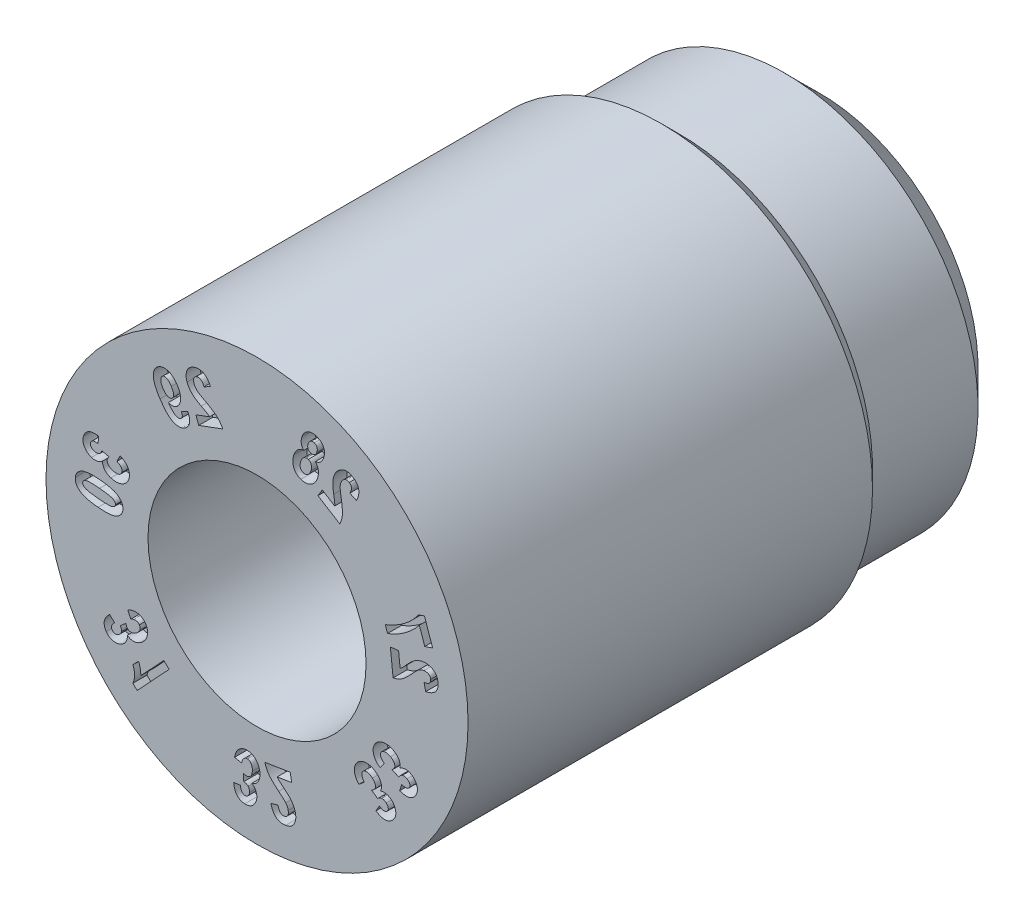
SolidWorks part; units mm, degrees
ref_plane "Front Plane" through (0, 0, 0) normal (0, 0, 1) x (1, 0, 0)
ref_plane "Top Plane" through (0, 0, 0) normal (0, 1, 0) x (1, 0, 0)
ref_plane "Right Plane" through (0, 0, 0) normal (1, 0, 0) x (0, 0, -1)
sketch "Sketch2" plane through (0, 0, 0) normal (0, 1, 0) x (1, 0, 0)
  line L0 (0, 4.8491) -> (0, -49995.1509) construction
  line L10 (2.2496, 8) -> (0.8, 8)
  line L11 (2.75, 7.4996) -> (2.2496, 8)
  line L12 (2.75, 6) -> (2.75, 7.4996)
  line L13 (3, 5.75) -> (2.75, 6)
  line L14 (3, 0) -> (3, 5.75)
  line L15 (1.55, 0) -> (3, 0)
  line L16 (1.55, 0) -> (1.55, 5.5)
  line L17 (0.8, 5.5) -> (1.55, 5.5)
  line L18 (0.8, 5.5) -> (0.8, 8)
  dimension "D1" = 6
  dimension "D2" = 3.1
  dimension "D3" = 2.5
  dimension "D4" = 1.6
  dimension "D5" = 5.5
  dimension "D6" = 8
  dimension "D7" = 45
  dimension "D8" = 45
  dimension "D9" = 2
  dimension "D10" = 0.5004
revolve "Revolve1" add sketch "Sketch2" angle 360 about L0
sketch "Sketch8" plane through (0, 0, 0) normal (0, 0, 1) x (1, 0, 0)
  line L0 (0, 0) -> (2.3455, 1.8705) construction
  line L1 (0, 0) -> (2.9248, -0.6676) construction
  line L2 (0, 0) -> (1.3017, -2.7029) construction
  line L3 (0, 0) -> (-1.3017, -2.7029) construction
  line L4 (0, 0) -> (-2.9248, -0.6676) construction
  line L5 (0, 0) -> (-2.3455, 1.8705) construction
  line L97 (0, 0) -> (0, 3) construction
  circle A30 centre (0, 0) radius 1.9367 construction
  circle A31 centre (0, 0) radius 3 construction
  text T0 "27    28    29    30    31    32    33" font "Arial Narrow" height 0.66
  point P10 (0, 0)
  dimension "D1" = 7
extrude "Cut-Extrude2" cut sketch "Sketch8" against normal blind 0.2
